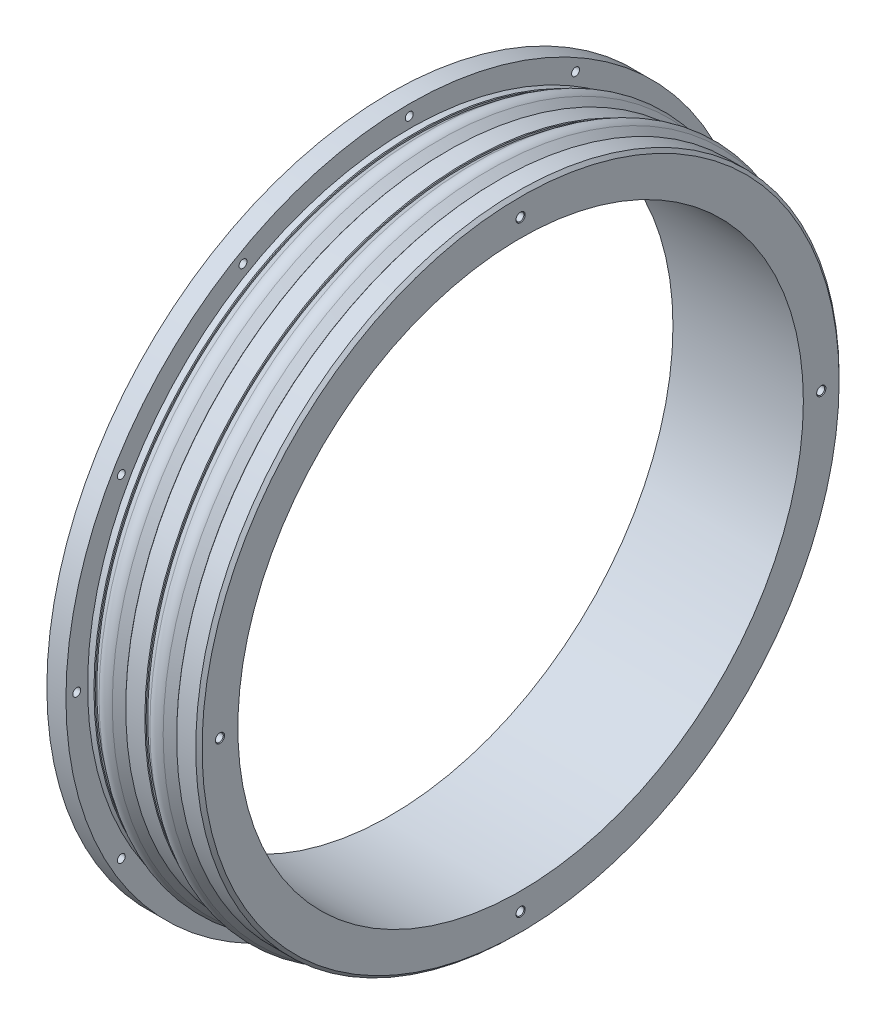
SolidWorks part; units mm, degrees
ref_plane "Front Plane" through (0, 0, 0) normal (0, 0, 1) x (1, 0, 0)
ref_plane "Top Plane" through (0, 0, 0) normal (0, 1, 0) x (1, 0, 0)
ref_plane "Right Plane" through (0, 0, 0) normal (1, 0, 0) x (0, 0, -1)
sketch "Sketch2" plane through (0, 0, 0) normal (0, 1, 0) x (1, 0, 0)
  line L0 (0, 0) -> (0, 88.9) construction
  line L1 (0, 88.9) -> (41, 88.9)
  line L2 (41, 88.9) -> (41, 101.15)
  line L3 (41, 101.15) -> (33.8, 101.15)
  line L4 (33.8, 101.15) -> (33.8, 100.15) construction
  line L5 (33.8, 100.15) -> (24.2, 100.15) construction
  line L6 (24.2, 100.15) -> (24.2, 101.15) construction
  line L7 (24.2, 101.15) -> (8.2, 101.15) construction
  line L8 (8.2, 101.15) -> (8.2, 100.15) construction
  line L9 (8.2, 100.15) -> (17.8, 100.15) construction
  line L10 (17.8, 100.15) -> (17.8, 101.15) construction
  line L11 (17.8, 101.15) -> (6, 101.15) construction
  line L12 (6, 101.15) -> (6, 107.95)
  line L13 (6, 107.95) -> (0, 107.95)
  line L14 (0, 107.95) -> (0, 101.27)
  line L15 (0, 101.27) -> (0.75, 101.27)
  line L16 (0.75, 101.27) -> (0.75, 98.171) construction
  line L17 (0.75, 98.171) -> (0, 98.171)
  line L18 (0, 98.171) -> (0, 88.9)
  line L19 (6, 101.4) -> (41, 101.4) construction
  line L20 (6, 101.62) -> (41, 101.62) construction
  line L21 (8.2, 100.45) -> (10.9167, 102.4624)
  line L22 (0, 0) -> (-153832.3837, 0) construction
  line L23 (13, 100.45) -> (13, 100.15) construction
  line L24 (6, 101.15) -> (8.2, 101.15)
  line L25 (17.8, 101.15) -> (24.2, 101.15)
  line L26 (15.0833, 102.4624) -> (17.8, 100.45)
  line L27 (24.2, 100.45) -> (26.9167, 102.4624)
  line L28 (29, 100.45) -> (29, 100.15) construction
  line L29 (31.0833, 102.4624) -> (33.8, 100.45)
  line L30 (0.0113, 100.7289) -> (0.75, 101.27)
  line L31 (0.0113, 98.7121) -> (0.75, 98.171)
  line L32 (8.2, 101.15) -> (8.2, 100.45)
  line L33 (17.8, 100.45) -> (17.8, 101.15)
  line L34 (24.2, 101.15) -> (24.2, 100.45)
  line L35 (33.8, 100.45) -> (33.8, 101.15)
  line L36 (8.2, 100.45) -> (17.8, 100.45) construction
  line L37 (24.2, 100.45) -> (33.8, 100.45) construction
  line L38 (41, 96.15) -> (0, 96.15) construction
  arc A0 (0.0113, 100.7289) -> (0.0113, 98.7121) centre (0.75, 99.7205) ccw
  arc A1 (10.9167, 102.4624) -> (15.0833, 102.4624) centre (13, 99.65) cw
  arc A2 (26.9167, 102.4624) -> (31.0833, 102.4624) centre (29, 99.65) cw
  dimension "D3" = 1.25
  dimension "D8" = 12
  dimension "D9" = 16
  dimension "D18" = 3.5
  dimension "D1" = 202.8
  dimension "D2" = 203.24
  dimension "D4" = 35
  dimension "D5" = 1
  dimension "D6" = 0.25
  dimension "D7" = 202.3
  dimension "D10" = 196.342
  dimension "D11" = 177.8
  dimension "D12" = 215.9
  dimension "D13" = 6
  dimension "D14" = 9.6
  dimension "D15" = 0.75
  dimension "D16" = 3.099
  dimension "D17" = 0.3
  dimension "D19" = 5
revolve "Revolve1" add sketch "Sketch2" angle 360 about L22
chamfer "Chamfer1" distance 1 angle 45 1 edges at (41, 0, -101.15)
chamfer "Chamfer2" distance 0.2 angle 45 6 edges at (0, 0, -98.171) (0, 0, -101.27) (33.8, 0, -101.15) (24.2, 0, -101.15) (17.8, 0, -101.15) (8.2, 0, -101.15)
sketch "Sketch3" plane through (6, 0, 0) normal (1, 0, 0) x (0, 0, -1)
  line L0 (0, 101.15) -> (0, 107.95) construction
  line L1 (0, -101.15) -> (0, -107.95) construction
  circle A1 centre (0, 0) radius 101.15 construction
  circle A2 centre (0, 0) radius 107.95 construction
  point P9 (0, 104.55)
  point P21 (0, 0)
  point P22 (52.275, 90.543)
  point P23 (90.543, 52.275)
  point P24 (104.55, 0)
  point P25 (90.543, -52.275)
  point P26 (52.275, -90.543)
  point P27 (0, -104.55)
  point P28 (-52.275, -90.543)
  point P29 (-90.543, -52.275)
  point P30 (-104.55, 0)
  point P31 (-90.543, 52.275)
  point P32 (-52.275, 90.543)
  point P33 (0, 0)
  dimension "D1" = 12
hole_wizard "Tap Drill for M3x0.5 Tap2" positions "3DSketch2" profile "Sketch6" hole size "M3x0.5" standard "ANSI Metric"
sketch3d "3DSketch2"
  point P0 (6, 104.55, 0)
  point P3 (6, 90.543, -52.275)
  point P6 (6, 52.275, -90.543)
  point P9 (6, 0, -104.55)
  point P12 (6, -52.275, -90.543)
  point P15 (6, -90.543, -52.275)
  point P18 (6, -104.55, 0)
  point P21 (6, -90.543, 52.275)
  point P24 (6, -52.275, 90.543)
  point P27 (6, 0, 104.55)
  point P30 (6, 52.275, 90.543)
  point P33 (6, 90.543, 52.275)
sketch "Sketch6" plane through (6, 104.55, 0) normal (0, 1, 0) x (0, 0, -1)
  line L0 (0, 0) -> (0, 6.5)
  line L1 (0, 6.5) -> (1.25, 6.5)
  line L2 (1.25, 6.5) -> (1.25, 0)
  line L5 (1.25, 0) -> (0, 0)
  line L11 (0, -6.35) -> (0, 107.95) construction
  dimension "Thru Hole Dia." = 2.5
  dimension "Thru Hole Depth" = 6.5
sketch "Sketch7" plane through (41, 0, 0) normal (1, 0, 0) x (0, 0, -1)
  line L0 (0, 100.15) -> (0, 88.9) construction
  line L1 (0, -100.15) -> (0, -88.9) construction
  circle A0 centre (0, 0) radius 100.15 construction
  circle A1 centre (0, 0) radius 88.9 construction
  point P7 (0, 94.525)
  point P11 (94.525, 0)
  point P12 (0, -94.525)
  point P13 (-94.525, 0)
  point P14 (0, 0)
  dimension "D1" = 4
hole_wizard "Tap Drill for M3x0.5 Tap3" positions "3DSketch3" profile "Sketch8" hole size "M3x0.5" standard "ANSI Metric"
sketch3d "3DSketch3"
  point P0 (41, 94.525, 0)
  point P3 (41, 0, -94.525)
  point P6 (41, -94.525, 0)
  point P9 (41, 0, 94.525)
sketch "Sketch8" plane through (41, 94.525, 0) normal (0, 1, 0) x (0, 0, -1)
  line L0 (0, 0) -> (0, 4.7511)
  line L1 (0, 4.7511) -> (1.25, 4)
  line L2 (1.25, 4) -> (1.25, 0)
  line L5 (1.25, 0) -> (0, 0)
  line L10 (0, 4.7511) -> (-1.25, 4) construction
  line L11 (0, -6.35) -> (0, 107.95) construction
  dimension "Hole Dia." = 2.5
  dimension "Hole Depth" = 4
  dimension "Drill Angle" = 118
chamfer "Chamfer3" distance 0.2 angle 45 4 edges at (41, 0, 93.275) (41, -94.525, -1.25) (41, 0, -95.775) (41, 94.525, -1.25)
chamfer "Chamfer4" distance 0.2 angle 45 12 edges at (0, -52.275, -89.293) (0, -90.543, -51.025) (0, -104.55, 1.25) (0, -90.543, 53.525) (0, -52.275, 91.793) (0, 0, 105.8) (0, 52.275, 91.793) (0, 90.543, 53.525) (0, 104.55, 1.25) (0, 90.543, -51.025) (0, 52.275, -89.293) (0, 0, -103.3)
